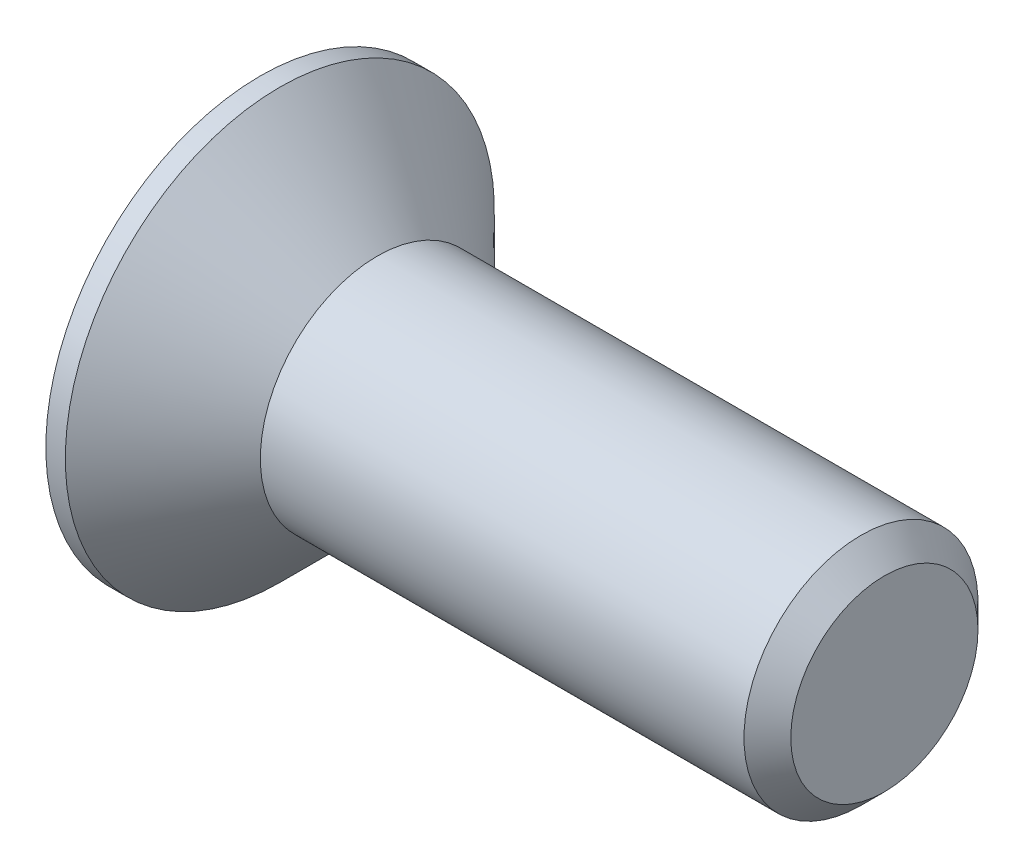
SolidWorks part; units mm, degrees
ref_plane "Front Plane" through (0, 0, 0) normal (0, 0, 1) x (1, 0, 0)
ref_plane "Top Plane" through (0, 0, 0) normal (0, 1, 0) x (1, 0, 0)
ref_plane "Right Plane" through (0, 0, 0) normal (1, 0, 0) x (0, 0, -1)
sketch "Sketch1" plane through (0, 0, 0) normal (0, 0, 1) x (1, 0, 0)
  line L1 (-3, 5.5) -> (-3, 0)
  line L2 (-3, 0) -> (13, 0)
  line L3 (13, 0) -> (13, 3)
  line L4 (13, 3) -> (0, 3)
  line L5 (-3, 5.5) -> (-2.5, 5.5)
  line L6 (-2.5, 5.5) -> (0, 3)
  dimension "D1" = 3
  dimension "D2" = 45
  dimension "D3" = 3
  dimension "D4" = 16
  dimension "D5" = 5.5
revolve "Revolve1" add sketch "Sketch1" angle 360 about L2
chamfer "Chamfer1" distance 0.6 angle 45 1 edges at (13, -3, 0)
sketch "Sketch2" plane through (-3, 0, 0) normal (-1, 0, 0) x (0, 0, 1)
  line L0 (-0.825, 3.3) -> (0.825, 3.3)
  line L1 (0.825, 3.3) -> (0.825, 0.825)
  line L2 (0.825, 0.825) -> (3.3, 0.825)
  line L3 (3.3, 0.825) -> (3.3, -0.825)
  line L4 (3.3, -0.825) -> (0.825, -0.825)
  line L5 (0.825, -0.825) -> (0.825, -3.3)
  line L6 (0.825, -3.3) -> (-0.825, -3.3)
  line L7 (-0.825, -3.3) -> (-0.825, -0.825)
  line L8 (-0.825, -0.825) -> (-3.3, -0.825)
  line L9 (-3.3, -0.825) -> (-3.3, 0.825)
  line L10 (-3.3, 0.825) -> (-0.825, 0.825)
  line L11 (-0.825, 0.825) -> (-0.825, 3.3)
  point P2 (0, 3.3)
  point P14 (0, -3.3)
  point P15 (3.3, 0)
  point P16 (-3.3, 0)
  dimension "D1" = 6.6
  dimension "D2" = 1.65
extrude "Cut-Extrude1" cut sketch "Sketch2" against normal blind 2.5
